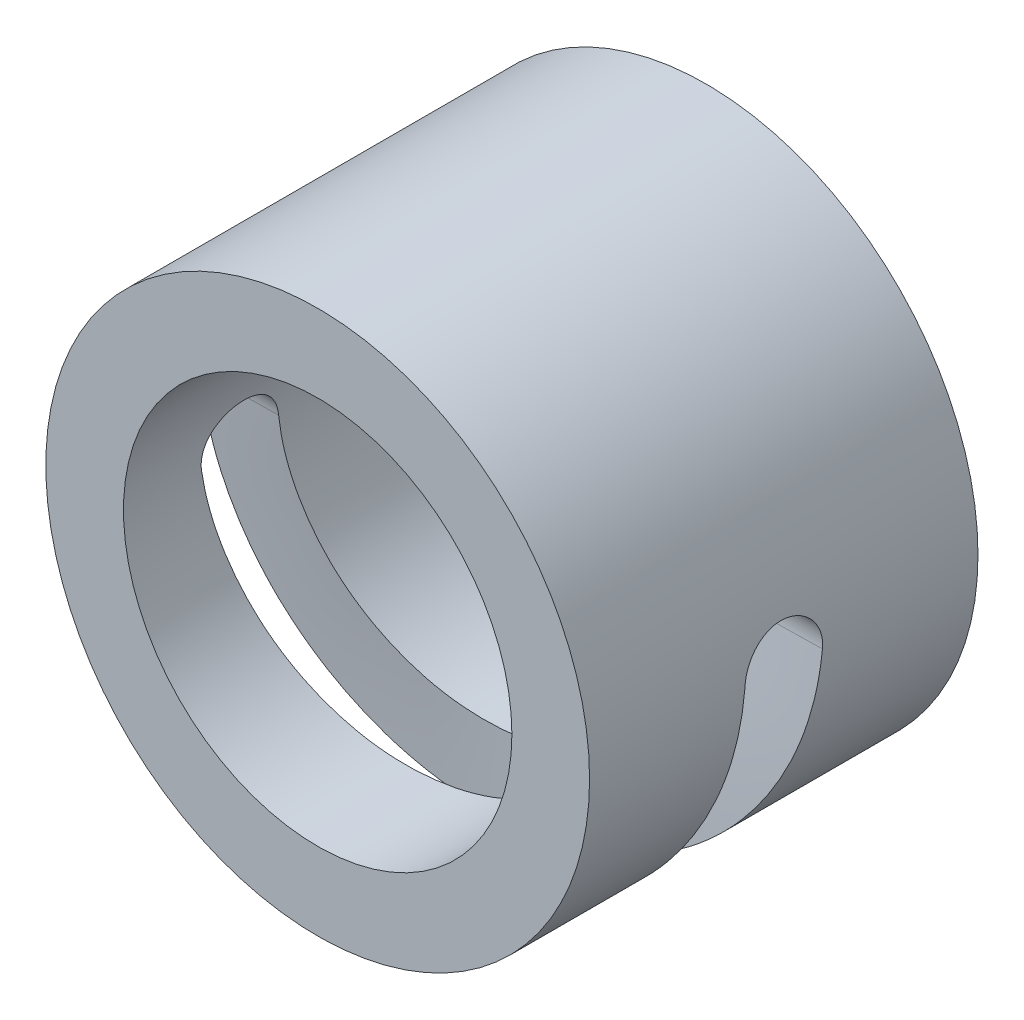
SolidWorks part; units mm, degrees
ref_plane "Vorderseite" through (0, 0, 0) normal (0, 0, 1) x (1, 0, 0)
ref_plane "oben" through (0, 0, 0) normal (0, 1, 0) x (-1, 0, 0)
ref_plane "rechts" through (0, 0, 0) normal (1, 0, 0) x (0, 0, -1)
sketch "Skizze1" plane through (0, 0, 0) normal (0, 0, 1) x (1, 0, 0)
  circle A0 centre (0, 0) radius 50
  circle A1 centre (0, 0) radius 70
  dimension "D1" = 20
  dimension "D2" = 100
extrude "Linear austragen1" add sketch "Skizze1" along normal mid plane 100
sketch "Skizze2" plane through (0, 0, 0) normal (0, 0, 1) x (1, 0, 0)
  circle A0 centre (0, 0) radius 60
  dimension "D1" = 120
curve "Spirale/Helix1"
sketch "Skizze3" plane through (0, 0, 0) normal (0, 1, 0) x (-1, 0, 0)
  line L0 (-75, 0) -> (-45, 0)
  spline S0 degree 3 poles (-60, 0) (-60, 0.3916) (-59.315, 1.1767) (-56.2677, 2.3529) (-51.3042, 3.5294) (-44.5936, 4.7059) (-36.3645, 5.8824) (-26.897, 7.0588) (-16.5135, 8.2353) (-5.5677, 9.4118) (5.5677, 10.5882) (16.5135, 11.7647) (26.897, 12.9412) (36.3645, 14.1176) (44.5936, 15.2941) (51.3042, 16.4706) (56.2677, 17.6471) (59.315, 18.8233) (60, 19.6084) (60, 20) knots 0 0 0 0 0.058824 0.117647 0.176471 0.235294 0.294118 0.352941 0.411765 0.470588 0.529412 0.588235 0.647059 0.705882 0.764706 0.823529 0.882353 0.941176 1 1 1 1 construction
  point P5 (-60, 0)
  dimension "D1" = 30
surface "Oberfläche-Austragung1 (Fräsermitte)"
ref_plane "Ebene1" through (-75, 0, 20) normal (-1, 0, 0) x (0, 0, 1)
ref_plane "Ebene2" through (75, 0, 0) normal (-1, 0, 0) x (0, 0, 1)
thicken "Schnitt-Wanddicke auftragen1 (Fräser-Ø)" thickness 10 thickness side both sides parameters "D1"=10
sketch "Skizze4" plane through (75, 0, 0) normal (-1, 0, 0) x (0, 0, 1)
  circle A0 centre (0, 0) radius 10.0002
extrude "Schnitt-Linear austragen1 (Fräserradius1)" cut sketch "Skizze4" along normal blind 59
sketch "Skizze5" plane through (-75, 0, 20) normal (-1, 0, 0) x (0, 0, 1)
  circle A0 centre (0, 0) radius 10.0001
extrude "Schnitt-Linear austragen2 (Fräserradius2)" cut sketch "Skizze5" against normal blind 60
